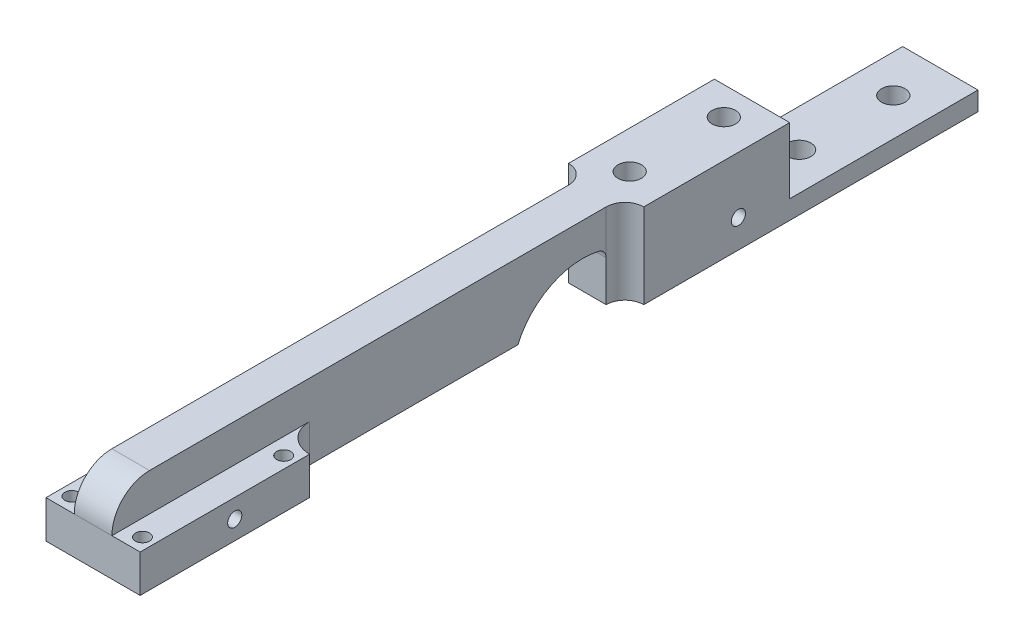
SolidWorks part; units mm, degrees
ref_plane "Front Plane" through (0, 0, 0) normal (0, 0, 1) x (1, 0, 0)
ref_plane "Top Plane" through (0, 0, 0) normal (0, 1, 0) x (1, 0, 0)
ref_plane "Right Plane" through (0, 0, 0) normal (1, 0, 0) x (0, 0, -1)
sketch "Sketch1" plane through (0, 0, 0) normal (0, 0, 1) x (1, 0, 0)
  line L1 (10, -2) -> (-10, -2)
  line L2 (10, -2) -> (10, 6)
  line L3 (10, 6) -> (-10, 6)
  line L4 (-10, -2) -> (-10, 6)
  dimension "D1" = 8
  dimension "D2" = 20
  dimension "D3" = 2
  dimension "D4" = 10
extrude "Boss-Extrude1" add sketch "Sketch1" along normal blind 140
sketch "Sketch2" plane through (0, 6, 0) normal (0, 1, 0) x (1, 0, 0)
  line L0 (-10, -140) -> (-10, 0) construction
  line L1 (-10, 0) -> (-4, 0)
  line L2 (-10, 0) -> (-10, -104)
  line L3 (10, -104) -> (10, 0)
  line L4 (-4, 0) -> (-4, -98)
  line L6 (0, 0) -> (0, -135.4663) construction
  line L7 (10, 0) -> (-10, 0) construction
  line L9 (4, 0) -> (4, -98)
  line L12 (10, 0) -> (4, 0)
  arc A0 (-4, -98) -> (-10, -104) centre (-10, -98) cw
  arc A1 (4, -98) -> (10, -104) centre (10, -98) ccw
  dimension "D2" = 36
  dimension "D3" = 6
  dimension "D1" = 6
extrude "Cut-Extrude1" cut sketch "Sketch2" against normal through all
sketch "Sketch3" plane through (0, 0, 0) normal (1, 0, 0) x (0, 0, -1)
  line L0 (0, -2) -> (0, 6) construction
  line L1 (-140, 6) -> (0, 6)
  line L3 (-132, 14) -> (0, 14)
  line L4 (0, 6) -> (0, 14)
  arc A0 (-140, 6) -> (-132, 14) centre (-132, 6) cw
  dimension "D2" = 8
  dimension "D1" = 8
extrude "Boss-Extrude2" add sketch "Sketch3" along normal mid plane 8
sketch "Sketch4" plane through (4, 0, 0) normal (1, 0, 0) x (0, 0, -1)
  line L0 (0, -2) -> (-98, -2) construction
  line L1 (-140, -2) -> (-140, 6) construction
  line L2 (-35, -2) -> (-35, 4.6491)
  line L3 (-53.7477, -2) -> (-35, -2)
  arc A0 (-36.5385, 6.5951) -> (-53.7477, -2) centre (-40, -8) ccw
  arc A1 (-35, 4.6491) -> (-36.5385, 6.5951) centre (-37, 4.6491) ccw
  point P0 (-40, -8)
  point P3 (-140, 2)
  dimension "D3" = 30
  dimension "D5" = 4
  dimension "D1" = 6
  dimension "D2" = 100
  dimension "D4" = 5
extrude "Cut-Extrude2" cut sketch "Sketch4" against normal through all
sketch "Sketch6" plane through (0, 14, 0) normal (0, 1, 0) x (1, 0, 0)
  line L0 (0, 0) -> (0, -36.4214) construction
  line L1 (-4, 0) -> (-8, 0)
  line L2 (-4, -35) -> (4, -35)
  line L3 (8, 0) -> (8, -31)
  line L4 (-8, 0) -> (-8, -31)
  line L7 (4, 0) -> (8, 0)
  line L8 (-4, 0) -> (4, 0)
  arc A0 (-4, -35) -> (-8, -31) centre (-8, -35) ccw
  arc A1 (4, -35) -> (8, -31) centre (8, -35) cw
  dimension "D3" = 4
  dimension "D4" = 35
  dimension "D1" = 35
  dimension "D2" = 4
extrude "Boss-Extrude3" add sketch "Sketch6" against normal blind 18
sketch "Sketch7" plane through (0, 0, 0) normal (0, 0, -1) x (-1, 0, 0)
  line L0 (-8, -4) -> (-8, 14) construction
  line L1 (8, -4) -> (-8, -4)
  line L2 (8, -4) -> (8, 0)
  line L3 (8, 0) -> (-8, 0)
  line L4 (-8, -4) -> (-8, 0)
  dimension "D1" = 4
  dimension "D2" = 16
extrude "Boss-Extrude4" add sketch "Sketch7" along normal blind 40
sketch "Sketch8" plane through (0, 6, 0) normal (0, 1, 0) x (1, 0, 0)
  line L1 (10, -140) -> (4, -140) construction
  line L3 (0, 0) -> (0, -174.9903) construction
  line L4 (10, -140) -> (10, -104) construction
  circle A0 centre (7.5, -137) radius 1.5
  circle A1 centre (7.5, -107) radius 1.5
  circle A2 centre (-7.5, -107) radius 1.5
  circle A3 centre (-7.5, -137) radius 1.5
  dimension "D1" = 3
  dimension "D4" = 3
  dimension "D2" = 2.5
  dimension "D3" = 3
  dimension "D5" = 30
  dimension "D6" = 2.5
extrude "Cut-Extrude3" cut sketch "Sketch8" against normal through all
sketch "Sketch9" plane through (0, -2, 0) normal (0, -1, 0) x (1, 0, 0)
  line L1 (-7.5, 137) -> (7.5, 137)
  line L2 (-7.5, 137) -> (-7.5, 107)
  line L3 (-7.5, 107) -> (7.5, 107)
  line L4 (7.5, 137) -> (7.5, 107)
extrude "Cut-Extrude4" cut sketch "Sketch9" against normal blind 1.5
sketch "Sketch10" plane through (0, -2, 0) normal (0, -1, 0) x (1, 0, 0)
  line L0 (0, 0) -> (0, 146.0869) construction
  line L1 (-10, 140) -> (10, 140) construction
  line L2 (3, 79) -> (3, 65)
  line L3 (-3, 79) -> (-3, 65)
  arc A0 (-3, 65) -> (3, 65) centre (0, 65) ccw
  arc A1 (3, 79) -> (-3, 79) centre (0, 79) ccw
  dimension "D3" = 6
  dimension "D4" = 6
  dimension "D1" = 61
  dimension "D2" = 14
extrude "Cut-Extrude5" cut sketch "Sketch10" against normal blind 2
sketch "Sketch11" plane through (0, 14, 0) normal (0, 1, 0) x (1, 0, 0)
  line L0 (0, 0) -> (0, -150.3475) construction
  line L1 (-8, 0) -> (8, 0) construction
  line L2 (10, -140) -> (4, -140) construction
  circle A0 centre (0, -26) radius 2.5
  circle A1 centre (0, -6) radius 2.5
  dimension "D1" = 5
  dimension "D2" = 5
  dimension "D4" = 20
  dimension "D3" = 114
extrude "Cut-Extrude6" cut sketch "Sketch11" against normal through all
sketch "Sketch12" plane through (0, 0, 0) normal (0, 1, 0) x (1, 0, 0)
  line L0 (0, 0) -> (0, 46.0869) construction
  line L1 (-8, 40) -> (8, 40) construction
  circle A0 centre (0, 10) radius 2.5
  circle A1 centre (0, 30) radius 2.5
  dimension "D1" = 5
  dimension "D2" = 5
  dimension "D3" = 10
  dimension "D4" = 20
extrude "Cut-Extrude7" cut sketch "Sketch12" against normal through all
sketch "Sketch13" plane through (10, 0, 0) normal (1, 0, 0) x (0, 0, -1)
  line L0 (-140, -2) -> (-104, -2) construction
  line L1 (-140, -2) -> (-140, 6) construction
  circle A0 centre (-119.9, 2) radius 1.5
  dimension "D1" = 3
  dimension "D2" = 4
  dimension "D3" = 20.1
extrude "Cut-Extrude8" cut sketch "Sketch13" against normal blind 15
sketch "Sketch14" plane through (8, 0, 0) normal (1, 0, 0) x (0, 0, -1)
  line L0 (-140, -2) -> (-104, -2) construction
  line L1 (-140, -2) -> (-140, 6) construction
  circle A0 centre (-10.9, 2) radius 1.5
  dimension "D1" = 3
  dimension "D2" = 4
  dimension "D3" = 129.1
extrude "Cut-Extrude9" cut sketch "Sketch14" against normal blind 15
